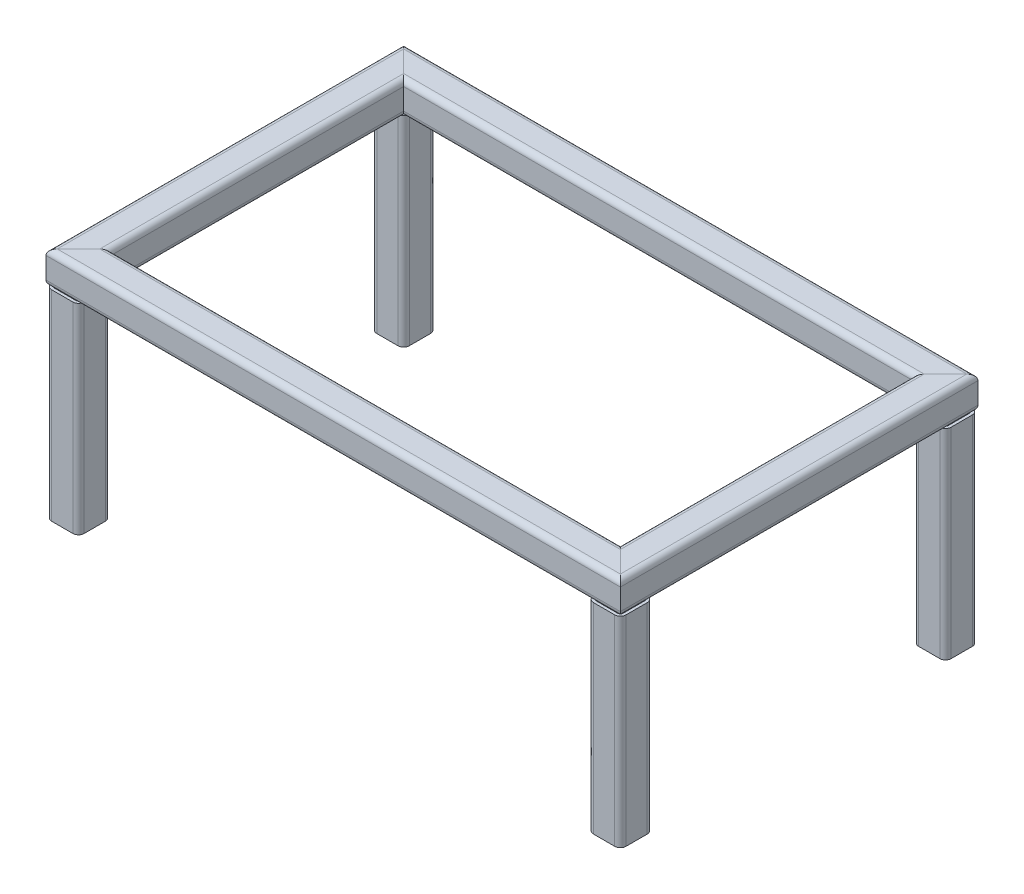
SolidWorks part; units mm, degrees
ref_plane "Front Plane" through (0, 0, 0) normal (0, 0, 1) x (1, 0, 0)
ref_plane "Top Plane" through (0, 0, 0) normal (0, 1, 0) x (1, 0, 0)
ref_plane "Right Plane" through (0, 0, 0) normal (1, 0, 0) x (0, 0, -1)
sketch "Sketch1" plane through (0, 0, 0) normal (0, 1, 0) x (1, 0, 0)
  line L1 (-250, 150) -> (250, 150)
  line L2 (-250, 150) -> (-250, -150)
  line L3 (-250, -150) -> (250, -150)
  line L4 (250, 150) -> (250, -150)
  line L5 (-250, 150) -> (250, -150) construction
  line L6 (-250, -150) -> (250, 150) construction
  point P0 (0, 0)
  dimension "D1" = 500
  dimension "D2" = 300
sketch3d "3DSketch1"
  line L0 (-250, 0, -150) -> (-250, -200, -150)
  line L1 (-250, 0, 150) -> (-250, -200, 150)
  line L2 (250, 0, 150) -> (250, -200, 150)
  line L3 (250, 0, -150) -> (250, -200, -150)
  dimension "D1" = 200
other "Square tube 30 X 30 X 2.6(1)"
ref_plane "Plane1" through (-250, 0, -150) normal (0, 0, 1) x (1, 0, 0)
sketch "Sketch18" plane through (-250, 0, -150) normal (0, 0, 1) x (1, 0, 0)
  line L0 (-9.8, -12.4) -> (9.8, -12.4)
  line L1 (-12.4, -9.8) -> (-12.4, 9.8)
  line L2 (9.8, 12.4) -> (-9.8, 12.4)
  line L3 (12.4, 9.8) -> (12.4, -9.8)
  line L4 (-9.8, -15) -> (9.8, -15)
  line L5 (-15, -9.8) -> (-15, 9.8)
  line L6 (9.8, 15) -> (-9.8, 15)
  line L7 (15, 9.8) -> (15, -9.8)
  arc A0 (15, 9.8) -> (9.8, 15) centre (9.8, 9.8) ccw
  arc A1 (9.8, -15) -> (15, -9.8) centre (9.8, -9.8) ccw
  arc A2 (-15, -9.8) -> (-9.8, -15) centre (-9.8, -9.8) ccw
  arc A3 (-9.8, 15) -> (-15, 9.8) centre (-9.8, 9.8) ccw
  arc A4 (-9.8, 12.4) -> (-12.4, 9.8) centre (-9.8, 9.8) ccw
  arc A5 (12.4, 9.8) -> (9.8, 12.4) centre (9.8, 9.8) ccw
  arc A6 (9.8, -12.4) -> (12.4, -9.8) centre (9.8, -9.8) ccw
  arc A7 (-12.4, -9.8) -> (-9.8, -12.4) centre (-9.8, -9.8) ccw
  point P0 (-15, 0)
  point P1 (15, 0)
  point P2 (0, 15)
  point P3 (0, -15)
  point P4 (0, 0)
  point P5 (-15, -15)
  point P6 (15, -15)
  point P7 (15, 15)
  point P8 (-15, 15)
  point P33 (0, 0)
  point P35 (0, 0)
  dimension "D1" = 5.2
  dimension "Thickness" = 2.6
  dimension "V_leg" = 30
